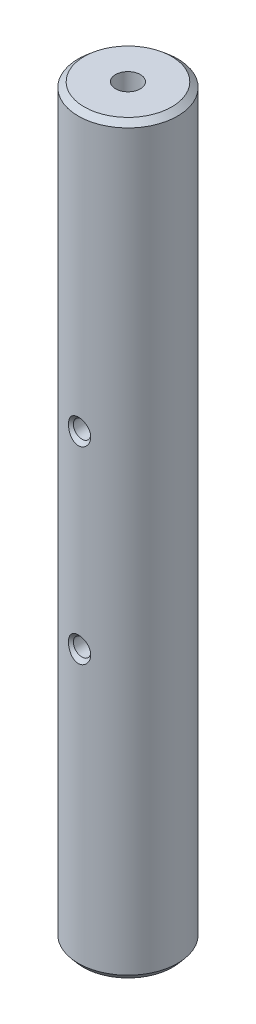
SolidWorks part; units mm, degrees
ref_plane "Front" through (0, 0, 0) normal (0, 0, 1) x (1, 0, 0)
ref_plane "Top" through (0, 0, 0) normal (0, 1, 0) x (1, 0, 0)
ref_plane "Right" through (0, 0, 0) normal (1, 0, 0) x (0, 0, -1)
sketch "Sketch1" plane through (0, 0, 0) normal (0, 1, 0) x (1, 0, 0)
  circle A0 centre (0, 0) radius 10
  dimension "D1" = 20
extrude "Boss-Extrude1" add sketch "Sketch1" along normal mid plane 150
chamfer "Chamfer1" distance 1 angle 50 2 edges at (0, -75, 10) (0, 75, 10)
hole_wizard "M6 Tapped Hole1" positions "Sketch3" profile "Sketch4" tap size "M6" standard "ISO"
sketch "Sketch3" plane through (0, 75, 0) normal (0, 1, 0) x (1, 0, 0)
  point P0 (0, 0)
sketch "Sketch4" plane through (0, 75, 0) normal (1, 0, 0) x (0, 0, 1)
  line L0 (0, 0) -> (0, 16.5022)
  line L1 (0, 16.5022) -> (2.5, 15)
  line L2 (2.5, 15) -> (2.5, 0)
  line L5 (2.5, 0) -> (0, 0)
  line L10 (0, 16.5022) -> (-2.5, 15) construction
  line L11 (0, -6.35) -> (0, 107.95) construction
  dimension "Tap Drill Dia." = 5
  dimension "Tap Drill Depth" = 15
  dimension "Drill Angle" = 118
hole_wizard "Ø4.0 (4) Diameter Hole1" positions "Sketch6" profile "Sketch7" hole size "Ø4.0" standard "ISO"
sketch "Sketch6" plane through (0, 75, 0) normal (0, 1, 0) x (1, 0, 0)
  point P0 (0, 0)
sketch "Sketch7" plane through (0, 75, 0) normal (1, 0, 0) x (0, 0, 1)
  line L0 (0, 0) -> (0, 61.2017)
  line L1 (0, 61.2017) -> (2, 60)
  line L2 (2, 60) -> (2, 0)
  line L5 (2, 0) -> (0, 0)
  line L10 (0, 61.2017) -> (-2, 60) construction
  line L11 (0, -6.35) -> (0, 107.95) construction
  dimension "Hole Dia." = 4
  dimension "Hole Depth" = 60
  dimension "Drill Angle" = 118
hole_wizard "Ø3.5 (3.5) Diameter Hole2" positions "3DSketch2" profile "Sketch10" hole size "Ø3.5" standard "IS"
sketch3d "3DSketch2"
  line L0 (0, 19, 10) -> (0, 0, 10) construction
  line L1 (0, 0, 10) -> (0, 0, 0) construction
  line L5 (0, 0, 10) -> (0, -19, 10) construction
  point P0 (0, 19, 10)
  dimension "D1" = 38
sketch "Sketch10" plane through (0, 19, 10) normal (1, 0, 0) x (0, -1, 0)
  line L0 (0, 0) -> (0, 20)
  line L1 (0, 20) -> (2.5, 20)
  line L2 (1.75, 19.25) -> (1.75, 0.75)
  line L3 (1.75, 0.75) -> (2.5, 0)
  line L5 (2.5, 0) -> (0, 0)
  line L6 (-1.75, 0.75) -> (-2.5, 0) construction
  line L7 (2.5, 20) -> (1.75, 19.25)
  line L8 (-2.5, 20) -> (-1.75, 19.25) construction
  line L11 (0, -6.35) -> (0, 107.95) construction
  dimension "Thru Hole Dia." = 3.5
  dimension "Thru Hole Depth" = 20
  dimension "Near C'Sink Dia." = 5
  dimension "Near C'Sink Angle" = 90
  dimension "Far C'Sink Dia." = 5
  dimension "Far C'Sink Angle" = 90
mirror "Mirror1" about plane through (0, 0, 0) normal (0, 1, 0) of "Ø3.5 (3.5) Diameter Hole2", "Ø4.0 (4) Diameter Hole1", "M6 Tapped Hole1"
